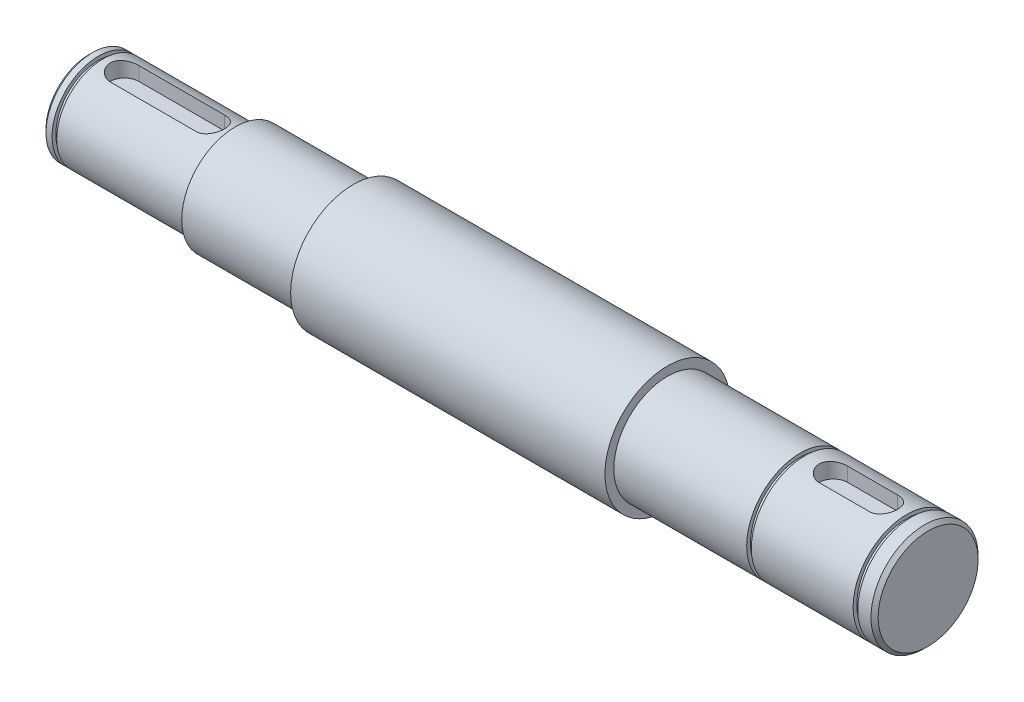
SolidWorks part; units mm, degrees
ref_plane "Ebene vorne" through (0, 0, 0) normal (0, 0, 1) x (1, 0, 0)
ref_plane "Ebene oben" through (0, 0, 0) normal (0, 1, 0) x (1, 0, 0)
ref_plane "Ebene rechts" through (0, 0, 0) normal (1, 0, 0) x (0, 0, -1)
sketch "Skizze1" plane through (0, 0, 0) normal (0, 0, 1) x (1, 0, 0)
  line L0 (0, 0) -> (235, 0) construction
  line L1 (0, 0) -> (0, 13)
  line L2 (0, 13) -> (2.7, 13)
  line L3 (4, 11.95) -> (4, 13)
  line L4 (4, 11.95) -> (2.7, 11.95)
  line L5 (2.7, 11.95) -> (2.7, 13)
  line L6 (41, 15) -> (74, 15)
  line L7 (74, 15) -> (74, 17.5)
  line L8 (74, 17.5) -> (162, 17.5)
  line L9 (162, 17.5) -> (162, 15)
  line L10 (162, 15) -> (199.2, 15)
  line L11 (199.2, 15) -> (199.2, 13.95)
  line L12 (199.2, 13.95) -> (200.5, 13.95)
  line L13 (200.5, 13.95) -> (200.5, 15)
  line L14 (200.5, 15) -> (229, 15)
  line L15 (229, 15) -> (229, 13.95)
  line L16 (229, 13.95) -> (230.3, 13.95)
  line L17 (230.3, 13.95) -> (230.3, 15)
  line L18 (230.3, 15) -> (235, 15)
  line L19 (235, 15) -> (235, 0)
  line L20 (4, 13) -> (41, 13)
  line L21 (41, 13) -> (41, 15)
  line L22 (0, 0) -> (235, 0)
  dimension "D1" = 235
  dimension "D2" = 26
  dimension "D3" = 23.9
  dimension "D4" = 35
  dimension "D5" = 30
  dimension "D6" = 1.3
  dimension "D7" = 2.7
  dimension "D8" = 41
  dimension "D9" = 74
  dimension "D10" = 73
  dimension "D11" = 1.3
  dimension "D12" = 1.3
  dimension "D13" = 4.7
  dimension "D14" = 34.5
  dimension "D15" = 30
  dimension "D16" = 27.9
revolve "Rotation1" add sketch "Skizze1" angle 360 about L0
ref_plane "Ebene1" through (0, 13, 0) normal (0, 1, 0) x (1, 0, 0)
sketch "Skizze2" plane through (0, 13, 0) normal (0, 1, 0) x (1, 0, 0)
  line L0 (10, 0) -> (34, 0) construction
  line L1 (10, 4) -> (34, 4)
  line L2 (10, -4) -> (34, -4)
  line L3 (0, 13) -> (0, -13) construction
  arc A0 (10, 4) -> (10, -4) centre (10, 0) ccw
  arc A1 (34, -4) -> (34, 4) centre (34, 0) ccw
  point P3 (22, 0)
  dimension "D1" = 24
  dimension "D2" = 8
  dimension "D3" = 34
extrude "Schnitt-Linear austragen1" cut sketch "Skizze2" against normal blind 4.5
ref_plane "Ebene2" through (0, 15, 0) normal (0, 1, 0) x (1, 0, 0)
sketch "Skizze3" plane through (0, 15, 0) normal (0, 1, 0) x (1, 0, 0)
  line L0 (208.5, 0) -> (222.5, 0) construction
  line L1 (208.5, 4) -> (222.5, 4)
  line L2 (208.5, -4) -> (222.5, -4)
  line L3 (235, -15) -> (235, 15) construction
  arc A0 (208.5, 4) -> (208.5, -4) centre (208.5, 0) ccw
  arc A1 (222.5, -4) -> (222.5, 4) centre (222.5, 0) ccw
  point P3 (215.5, 0)
  dimension "D2" = 26.5
  dimension "D3" = 4
  dimension "D1" = 14
extrude "Schnitt-Linear austragen2" cut sketch "Skizze3" against normal blind 4.5
chamfer "Fase1" distance 1 angle 45 2 edges at (0, 0, 13) (235, 0, 15)
